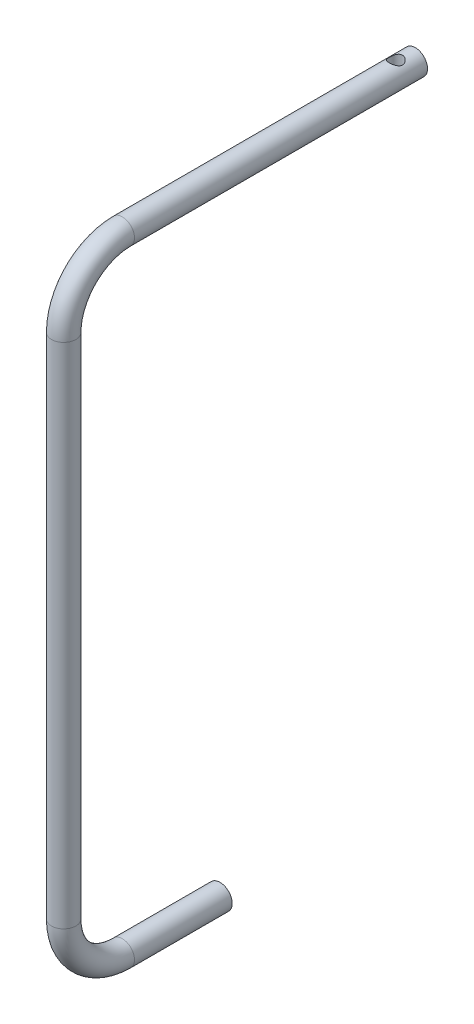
SolidWorks part; units mm, degrees
ref_plane "Front Plane" through (0, 0, 0) normal (0, 0, 1) x (1, 0, 0)
ref_plane "Top Plane" through (0, 0, 0) normal (0, 1, 0) x (1, 0, 0)
ref_plane "Right Plane" through (0, 0, 0) normal (1, 0, 0) x (0, 0, -1)
sketch "Sketch1" plane through (0, 0, 0) normal (0, 0, 1) x (1, 0, 0)
  circle A0 centre (0, 0) radius 3.9688
  dimension "D1" = 7.9375
sketch "Sketch2" plane through (0, 0, 0) normal (1, 0, 0) x (0, 0, -1)
  line L0 (0, 0) -> (-95.25, 0)
  line L1 (-114.3, -19.05) -> (-114.3, -184.15)
  line L2 (-95.25, -203.2) -> (-63.5, -203.2)
  arc A0 (-95.25, 0) -> (-114.3, -19.05) centre (-95.25, -19.05) ccw
  arc A1 (-114.3, -184.15) -> (-95.25, -203.2) centre (-95.25, -184.15) ccw
  point P7 (-114.3, 0)
  point P10 (-114.3, -203.2)
  dimension "D4" = 19.05
  dimension "D1" = 114.3
  dimension "D2" = 203.2
  dimension "D3" = 50.8
sweep "Sweep1" add profiles "Sketch1" path "Sketch2"
sketch "Sketch4" plane through (0, 0, 0) normal (0, 1, 0) x (1, 0, 0)
  line L0 (3.9688, 0) -> (-3.9688, 0) construction
  circle A0 centre (0, -6.35) radius 2.159
  dimension "D1" = 4.318
  dimension "D2" = 6.35
extrude "Cut-Extrude1" cut sketch "Sketch4" against normal mid plane 10.16
